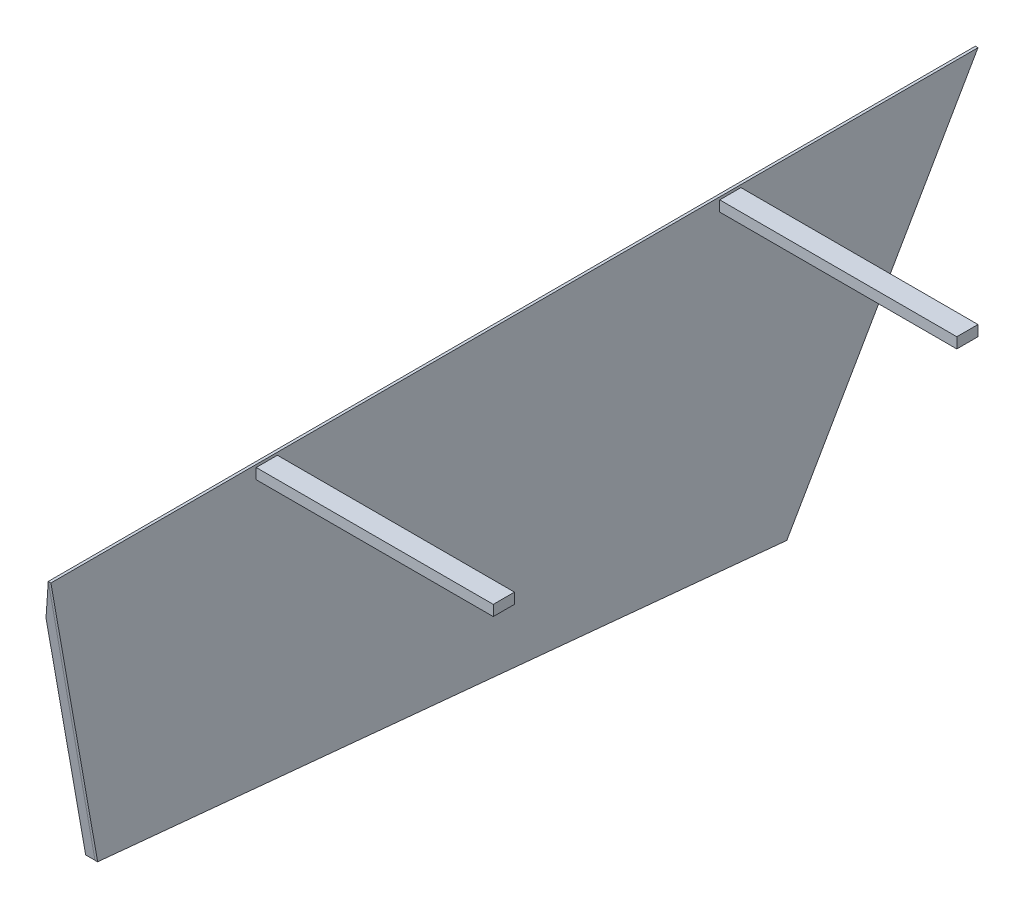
SolidWorks part; units mm, degrees
ref_plane "Front Plane" through (0, 0, 0) normal (0, 0, 1) x (1, 0, 0)
ref_plane "Top Plane" through (0, 0, 0) normal (0, 1, 0) x (1, 0, 0)
ref_plane "Right Plane" through (0, 0, 0) normal (1, 0, 0) x (0, 0, -1)
sketch "Sketch1" plane through (0, 0, 0) normal (1, 0, 0) x (0, 0, -1)
  line L1 (-1929.3355, -750) -> (816.9873, -750) construction
  line L3 (-2105.6624, 250) -> (1394.3376, 250)
  line L5 (-2079.2134, 100) -> (-1929.3355, -750) construction
  line L6 (-1953.3484, 250) -> (-2105.6624, 250) construction
  line L7 (1394.3376, 250) -> (816.9873, -750)
  line L8 (-2105.6624, 250) -> (-1929.3355, -750)
  line L9 (-1929.3355, -750) -> (672.6497, -1000)
  line L10 (672.6497, -1000) -> (816.9873, -750)
  point P0 (0, 0)
  dimension "D1" = 1000
  dimension "D2" = 3500
  dimension "D3" = 120
  dimension "D4" = 250
extrude "Boss-Extrude1" add sketch "Sketch1" along normal mid plane 10
sketch "Sketch2" plane through (0, 0, 0) normal (1, 0, 0) x (0, 0, -1)
  line L0 (1394.3376, 250) -> (459.3376, 250) construction
  line L1 (1394.3376, 250) -> (-2105.6624, 250) construction
  line L2 (459.3376, 250) -> (-1290.6624, 250) construction
  line L3 (-1290.6624, 250) -> (-1290.6624, 220) construction
  line L4 (459.3376, 250) -> (459.3376, 220) construction
  line L6 (419.3376, 200) -> (499.3376, 200)
  line L7 (419.3376, 200) -> (419.3376, 240)
  line L12 (419.3376, 240) -> (499.3376, 240)
  line L13 (499.3376, 200) -> (499.3376, 240)
  line L18 (419.3376, 200) -> (499.3376, 240) construction
  line L19 (419.3376, 240) -> (499.3376, 200) construction
  line L24 (-1330.6624, 200) -> (-1250.6624, 200)
  line L25 (-1330.6624, 200) -> (-1330.6624, 240)
  line L30 (-1330.6624, 240) -> (-1250.6624, 240)
  line L31 (-1250.6624, 200) -> (-1250.6624, 240)
  line L32 (-1330.6624, 200) -> (-1250.6624, 240) construction
  line L33 (-1330.6624, 240) -> (-1250.6624, 200) construction
  point P11 (459.3376, 220)
  point P14 (-1290.6624, 220)
  dimension "D1" = 935
  dimension "D2" = 1750
  dimension "D3" = 30
  dimension "D4" = 30
  dimension "D5" = 80
  dimension "D6" = 40
  dimension "D7" = 80
  dimension "D8" = 40
extrude "Boss-Extrude2" add sketch "Sketch2" along normal blind 900
sketch "Sketch5" plane through (-5, 0, 0) normal (-1, 0, 0) x (0, 0, 1)
  line L0 (-1394.3376, 250) -> (-672.6497, -1000)
  line L1 (-672.6497, -1000) -> (-508.5477, -984.233)
  line L3 (-508.5477, -984.233) -> (-1221.1325, 250)
  line L4 (-1394.3376, 250) -> (2105.6624, 250) construction
  line L5 (-1221.1325, 250) -> (-1394.3376, 250)
  line L6 (2105.6624, 250) -> (1929.3355, -750)
  line L7 (1929.3355, -750) -> (1774.3966, -764.8866)
  line L8 (1774.3966, -764.8866) -> (1953.3484, 250)
  line L9 (1953.3484, 250) -> (2105.6624, 250)
  line L10 (1929.3355, -750) -> (-672.6497, -1000) construction
  line L11 (2105.6624, 250) -> (1929.3355, -750) construction
  line L12 (2105.6624, 250) -> (1929.3355, -750) construction
  line L13 (1929.3355, -750) -> (-672.6497, -1000) construction
  dimension "D1" = 150
  dimension "D2" = 150
extrude "Boss-Extrude3" add sketch "Sketch5" along normal blind 35 separate body
chamfer "Chamfer1" distance 35 distance2 150 1 edges at (-40, 250, -1307.735)
chamfer "Chamfer2" distance 35 distance2 150 1 edges at (-40, 250, 2029.5054)
